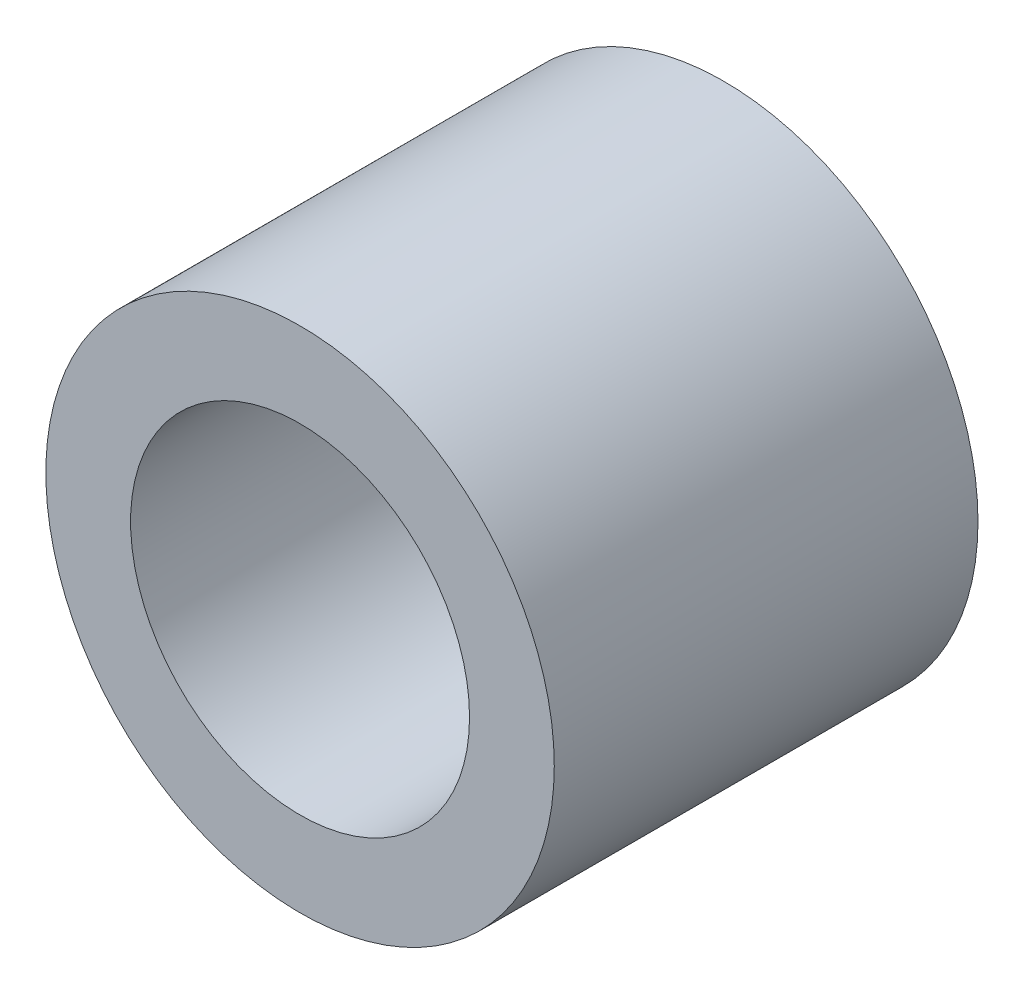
SolidWorks part; units mm, degrees
ref_plane "Face" through (0, 0, 0) normal (0, 0, 1) x (1, 0, 0)
ref_plane "Dessus" through (0, 0, 0) normal (0, 1, 0) x (1, 0, 0)
ref_plane "Droite" through (0, 0, 0) normal (1, 0, 0) x (0, 0, -1)
ref_plane "Plan1" through (0, 0, 7) normal (0, 0, 1) x (1, 0, 0)
sketch "Esquisse3" plane through (0, 0, 7) normal (0, 0, 1) x (1, 0, 0)
  circle A0 centre (0, 0) radius 3
  dimension "D1" = 6
extrude "Boss.-Extru.2" add sketch "Esquisse3" against normal blind 5
sketch "Esquisse4" plane through (0, 0, 7) normal (0, 0, 1) x (1, 0, 0)
  circle A0 centre (0, 0) radius 2
  dimension "D1" = 4
extrude "Enlèv. mat.-Extru.1" cut sketch "Esquisse4" against normal through all
